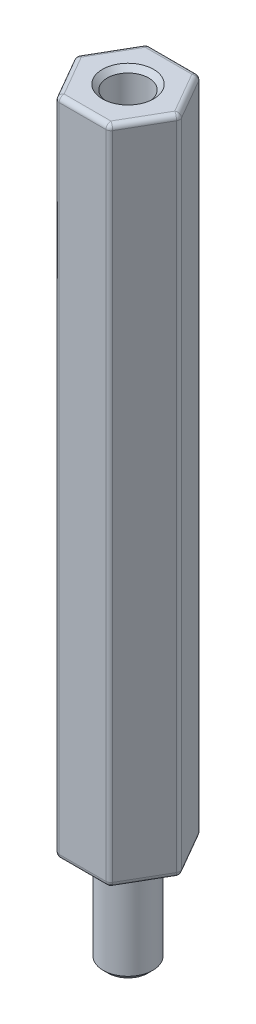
SolidWorks part; units mm, degrees
ref_plane "Front Plane" through (0, 0, 0) normal (0, 0, 1) x (1, 0, 0)
ref_plane "Top Plane" through (0, 0, 0) normal (0, 1, 0) x (1, 0, 0)
ref_plane "Right Plane" through (0, 0, 0) normal (1, 0, 0) x (0, 0, -1)
sketch "Sketch1" plane through (0, 0, 0) normal (0, 1, 0) x (1, 0, 0)
  line L1 (-1.5877, 2.75) -> (-3.1754, 0)
  line L2 (-3.1754, 0) -> (-1.5877, -2.75)
  line L3 (-1.5877, -2.75) -> (1.5877, -2.75)
  line L4 (1.5877, -2.75) -> (3.1754, 0)
  line L5 (3.1754, 0) -> (1.5877, 2.75)
  line L6 (1.5877, 2.75) -> (-1.5877, 2.75)
  circle A0 centre (0, 0) radius 2.75 construction
  circle A1 centre (0, 0) radius 1.25
  dimension "D2" = 2.5
  dimension "D1" = 5.5
extrude "Boss-Extrude1" add sketch "Sketch1" along normal blind 40
fillet "Fillet1" radius 0.3 6 edges at (1.5877, 20, -2.75) (3.1754, 20, 0) (-1.5877, 20, -2.75) (-3.1754, 20, 0) (-1.5877, 20, 2.75) (1.5877, 20, 2.75)
fillet "Fillet2" radius 0.3 24 edges at (-1.5645, 0, 2.7098) (-2.3816, 0, 1.375) (-3.129, 0, 0) (-2.3816, 0, -1.375) (-1.5645, 0, -2.7098) (0, 0, -2.75) (1.5645, 0, -2.7098) (2.3816, 0, -1.375) (3.129, 0, 0) (2.3816, 0, 1.375) (1.5645, 0, 2.7098) (-1.5645, 40, 2.7098) (-2.3816, 40, 1.375) (-3.129, 40, 0) (-2.3816, 40, -1.375) (-1.5645, 40, -2.7098) (0, 40, -2.75) (1.5645, 40, -2.7098) (2.3816, 40, -1.375) (3.129, 40, 0) (2.3816, 40, 1.375) (1.5645, 40, 2.7098) (0, 0, 2.75) (0, 40, 2.75)
sketch "Sketch2" plane through (0, 0, 0) normal (0, -1, 0) x (1, 0, 0)
  circle A0 centre (0, 0) radius 1.5
  dimension "D1" = 3
extrude "Boss-Extrude2" add sketch "Sketch2" along normal blind 6
chamfer "Chamfer1" distance 0.3 angle 45 2 edges at (0, 40, 1.25) (0, -6, -1.5)
fillet "Fillet3" radius 0.3 1 edges at (0, 0, 1.5)
